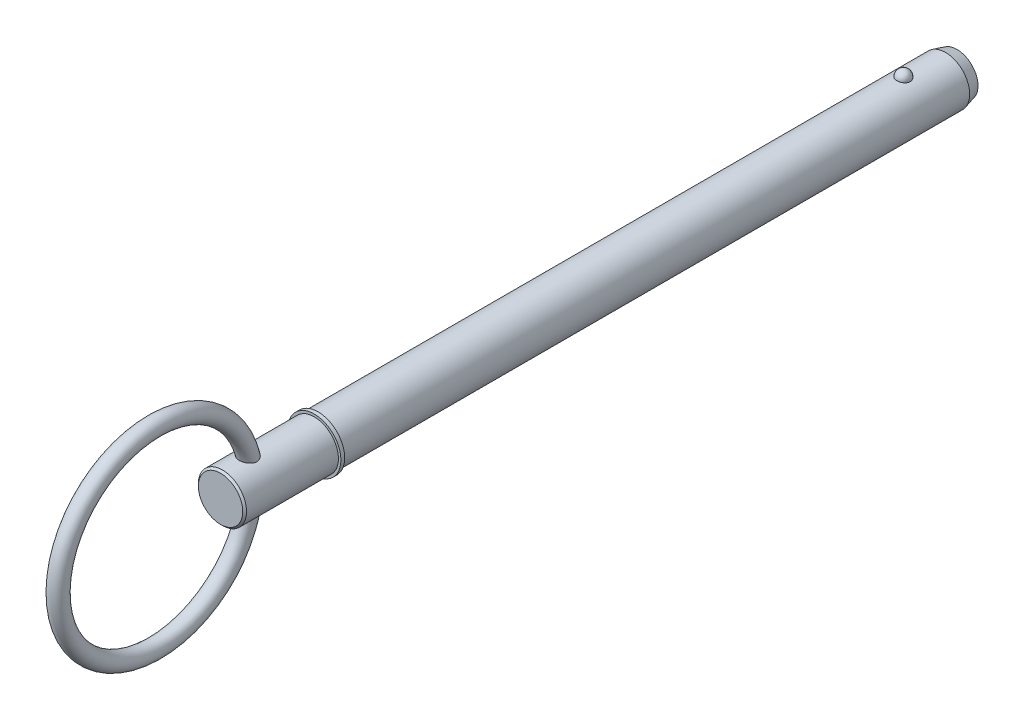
SolidWorks part; units mm, degrees
ref_plane "Front Plane" through (0, 0, 0) normal (0, 0, 1) x (1, 0, 0)
ref_plane "Top Plane" through (0, 0, 0) normal (0, 1, 0) x (1, 0, 0)
ref_plane "Right Plane" through (0, 0, 0) normal (1, 0, 0) x (0, 0, -1)
sketch "Sketch2" plane through (0, 0, 0) normal (0, 0, 1) x (1, 0, 0)
  circle A0 centre (0, 0) radius 6.35
  point P3 (0, 6.35)
  dimension "D1" = 12.7
extrude "Boss-Extrude1" add sketch "Sketch2" along normal blind 152.4
sketch "Sketch3" plane through (0, 0, 0) normal (0, 0, -1) x (-1, 0, 0)
  circle A0 centre (0, 0) radius 6.35
  dimension "D1" = 12.7
extrude "Boss-Extrude2" add sketch "Sketch3" along normal blind 15.88
chamfer "Chamfer1" distance 3 angle 15 1 edges at (-6.35, 0, -15.88)
sketch "Sketch18" plane through (0, 0, 0) normal (1, 0, 0) x (0, 0, -1)
  line L0 (12.88, 6.35) -> (-152.4, 6.35) construction
  line L1 (1.78, 8.13) -> (1.78, 4.57)
  line L2 (-152.4, -6.35) -> (12.88, -6.35) construction
  arc A0 (1.78, 8.13) -> (1.78, 4.57) centre (1.78, 6.35) ccw
  point P4 (0, 6.35)
  dimension "D1" = 14.48
revolve "Revolve1" add sketch "Sketch18" angle 360 about L1
sketch "Sketch19" plane through (0, 0, 0) normal (1, 0, 0) x (0, 0, -1)
  line L0 (-33.7288, 0) -> (-46.4542, 0) construction
sketch "Sketch20" plane through (0, 0, 0) normal (1, 0, 0) x (0, 0, -1)
  line L0 (-152.4, 0) -> (-152.4, 7)
  line L1 (-152.4, 6.35) -> (-152.4, -6.35) construction
  line L2 (-152.4, 7) -> (-153.4, 7)
  line L3 (-153.4, 7) -> (-153.4, 0)
  line L4 (-33.7288, 0) -> (-46.4542, 0) construction
  line L5 (-153.4, 0) -> (-152.4, 0)
  dimension "D1" = 7
  dimension "D2" = 1
revolve "Revolve2" add sketch "Sketch20" angle 360 about L0
sketch "Sketch21" plane through (0, 0, 152.4) normal (0, 0, -1) x (-1, 0, 0)
  circle A0 centre (0, 0) radius 6.35
  dimension "D1" = 12.7
extrude "Boss-Extrude3" add sketch "Sketch21" against normal blind 25.7
chamfer "Chamfer2" distance 0.5 angle 45 1 edges at (-6.35, 0, 178.1)
sketch "Sketch23" plane through (0, 0, 0) normal (1, 0, 0) x (0, 0, -1)
  line L0 (-178.1, 5.85) -> (-178.1, -5.85) construction
  circle A0 centre (-195.5, 0) radius 25.4
  point P2 (-170.1, 0)
  dimension "D1" = 50.8
  dimension "D2" = 8
sketch "Sketch24" plane through (0, 0, 0) normal (0, 1, 0) x (1, 0, 0)
  circle A0 centre (0, -170.1) radius 2.25
  dimension "D1" = 4.5
sweep "Sweep1" add profiles "Sketch24" path "Sketch23"
